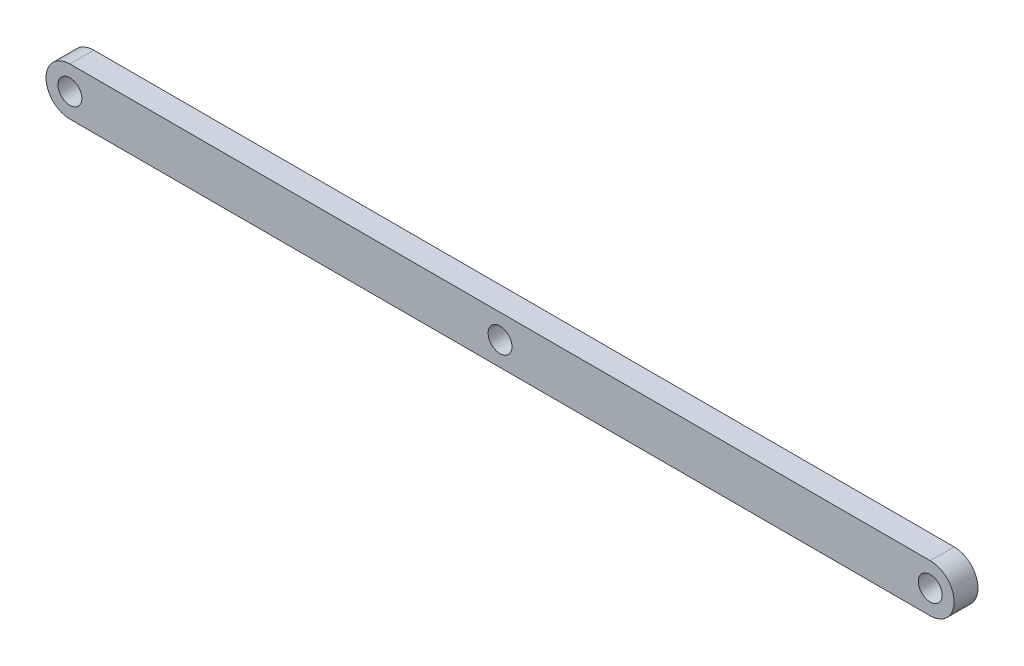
SolidWorks part; units mm, degrees
ref_plane "Front Plane" through (0, 0, 0) normal (0, 0, 1) x (1, 0, 0)
ref_plane "Top Plane" through (0, 0, 0) normal (0, 1, 0) x (1, 0, 0)
ref_plane "Right Plane" through (0, 0, 0) normal (1, 0, 0) x (0, 0, -1)
sketch "Sketch1" plane through (0, 0, 0) normal (0, 0, 1) x (1, 0, 0)
  line L0 (0, 0) -> (114.3, 0) construction
  line L1 (0, 3.175) -> (114.3, 3.175)
  line L2 (0, -3.175) -> (114.3, -3.175)
  arc A0 (0, 3.175) -> (0, -3.175) centre (0, 0) ccw
  arc A1 (114.3, -3.175) -> (114.3, 3.175) centre (114.3, 0) ccw
  circle A2 centre (0, 0) radius 1.5875
  circle A3 centre (114.3, 0) radius 1.5875
  circle A4 centre (57.15, 0) radius 1.5875
  point P3 (57.15, 0)
  dimension "D1" = 3.175
  dimension "D2" = 3.175
  dimension "D3" = 114.3
extrude "Boss-Extrude1" add sketch "Sketch1" along normal blind 3.175
